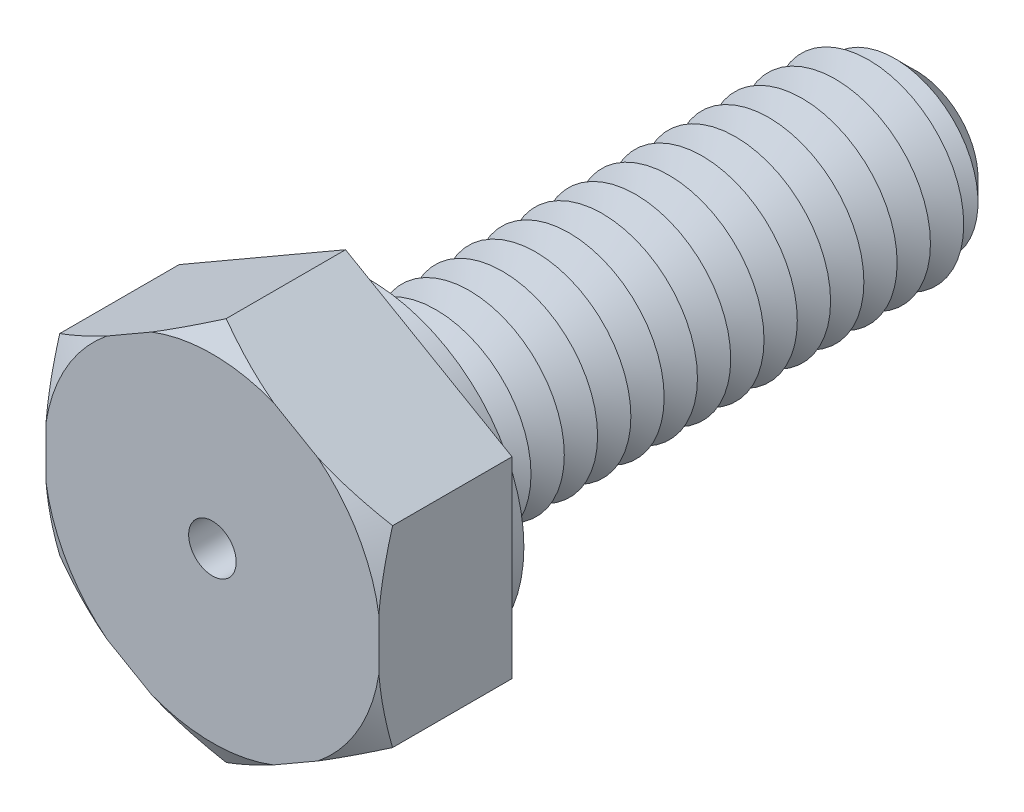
SolidWorks part; units mm, degrees
ref_plane "Front Plane" through (0, 0, 0) normal (0, 0, 1) x (1, 0, 0)
ref_plane "Top Plane" through (0, 0, 0) normal (0, 1, 0) x (1, 0, 0)
ref_plane "Right Plane" through (0, 0, 0) normal (1, 0, 0) x (0, 0, -1)
sketch "Sketch2" plane through (0, 0, 0) normal (0, 0, 1) x (1, 0, 0)
  line L1 (0, 4.0415) -> (-3.5, 2.0207)
  line L2 (-3.5, 2.0207) -> (-3.5, -2.0207)
  line L3 (-3.5, -2.0207) -> (0, -4.0415)
  line L4 (0, -4.0415) -> (3.5, -2.0207)
  line L5 (3.5, -2.0207) -> (3.5, 2.0207)
  line L6 (3.5, 2.0207) -> (0, 4.0415)
  circle A0 centre (0, 0) radius 3.5 construction
  dimension "D1" = 7
extrude "Boss-Extrude1" add sketch "Sketch2" along normal blind 2.8
sketch "Sketch3" plane through (0, 0, 0) normal (0, 0, -1) x (-1, 0, 0)
  circle A0 centre (0, 0) radius 2
  dimension "D1" = 4
extrude "Boss-Extrude2" add sketch "Sketch3" along normal blind 12
sketch "Sketch4" plane through (0, 0, 0) normal (0, 0, -1) x (-1, 0, 0)
  circle A0 centre (0, 0) radius 3.25
  dimension "D1" = 6.5
extrude "Boss-Extrude3" add sketch "Sketch4" along normal blind 0.5
sketch "Sketch5" plane through (0, 0, 0) normal (1, 0, 0) x (0, 0, -1)
  line L0 (-3.2117, 0) -> (6.3192, 0) construction
chamfer "Chamfer1" distance 0.7 angle 45 1 edges at (-2, 0, -12)
sketch "Sketch6" plane through (0, 0, 0) normal (1, 0, 0) x (0, 0, -1)
  line L0 (0.5, 2) -> (0.85, 1.3938)
  line L1 (0.85, 1.3938) -> (1.2, 2)
  line L2 (11.3, 2) -> (0.5, 2) construction
  line L3 (1.2, 2) -> (0.5, 2)
  dimension "D1" = 0.7
revolve "Cut-Revolve1" cut sketch "Sketch6" angle 360 about L0
pattern_linear "LPattern1" count 16 spacing 0.7 along (0, 0, -1) of "Cut-Revolve1"
sketch "Sketch7" plane through (0, 0, 0) normal (1, 0, 0) x (0, 0, -1)
  line L0 (-2.8, 4.0415) -> (-2.8, 3.5415)
  line L1 (-2.8, 2.0207) -> (-2.8, 4.0415) construction
  line L2 (-2.8, 3.5415) -> (-2.5113, 4.0415)
  line L3 (-2.8, 4.0415) -> (0, 4.0415) construction
  line L4 (-2.5113, 4.0415) -> (-2.8, 4.0415)
  dimension "D1" = 0.5
  dimension "D2" = 30
revolve "Cut-Revolve2" cut sketch "Sketch7" angle 360 about L0
sketch "Sketch8" plane through (0, 0, 2.8) normal (0, 0, 1) x (1, 0, 0)
  circle A0 centre (0, 0) radius 0.5
  dimension "D1" = 1
extrude "Cut-Extrude1" cut sketch "Sketch8" against normal up to surface (14.8 mm away)
